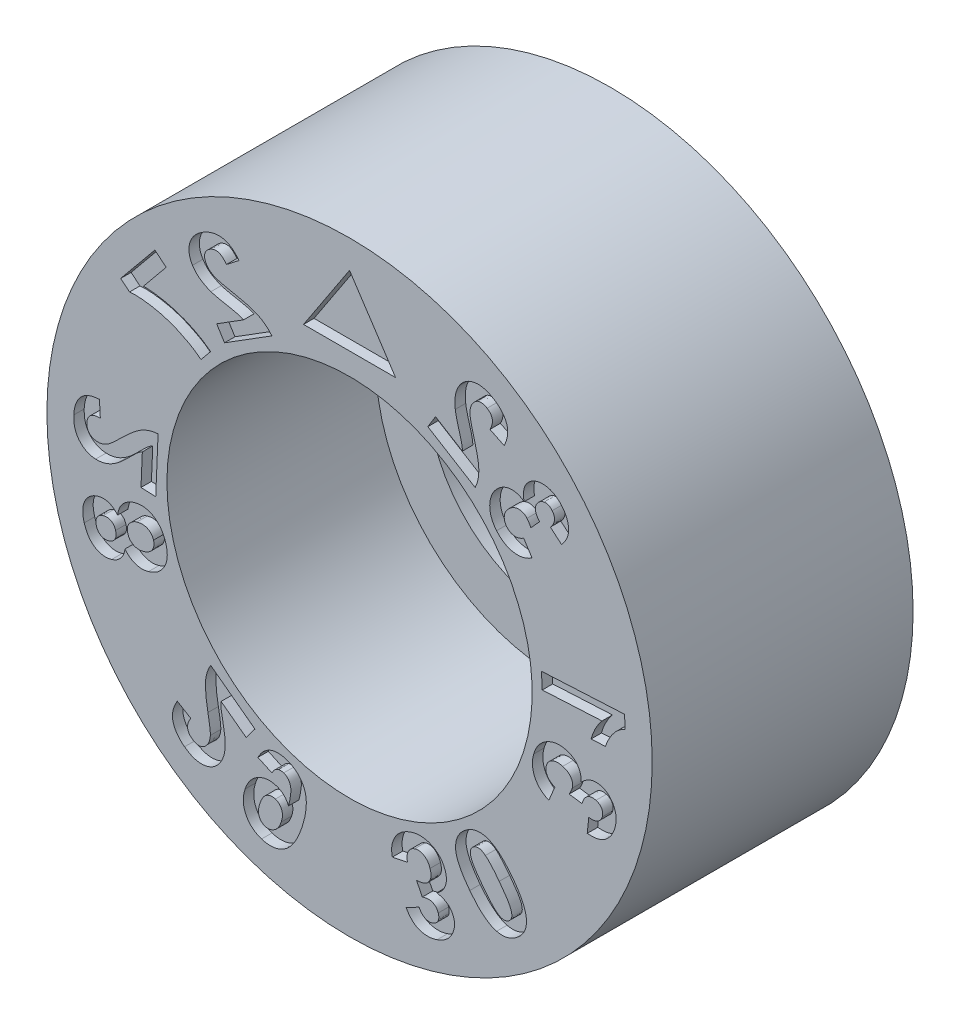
SolidWorks part; units mm, degrees
ref_plane "Front Plane" through (0, 0, 0) normal (0, 0, 1) x (1, 0, 0)
ref_plane "Top Plane" through (0, 0, 0) normal (0, 1, 0) x (1, 0, 0)
ref_plane "Right Plane" through (0, 0, 0) normal (1, 0, 0) x (0, 0, -1)
imported_body "Imported1"
other "Move Face2" parameters "D1"=0.157
other "DeleteFace1"
sketch "Sketch1" plane through (0, 0, 0) normal (0, 0, 1) x (1, 0, 0)
  arc A0 (-0.7207, 1.729) -> (0.7207, 1.729) centre (0, 0) ccw construction
  text T3 "27  28  29  30  31  32" font "Arial" height 0.8
  dimension "D1" = 1.8732
extrude "Cut-Extrude1" cut sketch "Sketch1" against normal blind 0.1
other "Move Face3" parameters "D1"=0.5
sketch "Sketch2" plane through (0, 0, 0) normal (0, 1, 0) x (1, 0, 0)
  line L0 (2.9, 2.5) -> (-2.9, 2.5) construction
  line L1 (-1.8, 2.5) -> (-2.2, 2.5)
  arc A0 (-2.2, 2.5) -> (-1.8, 2.5) centre (-2, 2.5) cw
  dimension "D1" = 0.2
  dimension "D2" = 2
revolve "Revolve1" add sketch "Sketch2" angle 360 about L1
